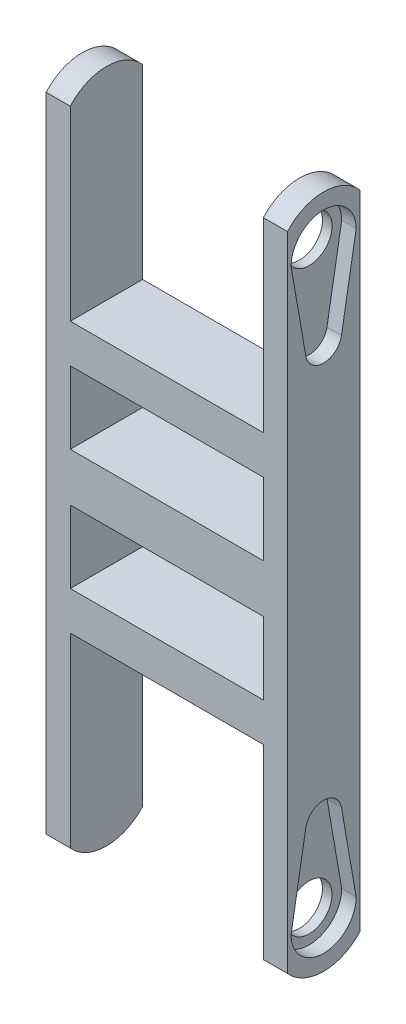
SolidWorks part; units mm, degrees
ref_plane "Front Plane" through (0, 0, 0) normal (0, 0, 1) x (1, 0, 0)
ref_plane "Top Plane" through (0, 0, 0) normal (0, 1, 0) x (1, 0, 0)
ref_plane "Right Plane" through (0, 0, 0) normal (1, 0, 0) x (0, 0, -1)
sketch "Sketch1" plane through (0, 0, 0) normal (0, 0, 1) x (1, 0, 0)
  line L1 (-30, -70) -> (30, -70)
  line L2 (-30, -70) -> (-30, 70)
  line L3 (-30, 70) -> (30, 70)
  line L4 (30, -70) -> (30, 70)
  line L5 (-30, -70) -> (30, 70) construction
  line L6 (-30, 70) -> (30, -70) construction
  point P0 (0, 0)
  dimension "D1" = 140
  dimension "D2" = 60
extrude "Boss-Extrude1" add sketch "Sketch1" along normal blind 15
sketch "Sketch2" plane through (0, 0, 15) normal (0, 0, 1) x (1, 0, 0)
  line L0 (30, 70) -> (-30, 70) construction
  line L1 (-20.025, 70) -> (20.025, 70)
  line L2 (-20.025, 70) -> (-20.025, 28)
  line L3 (-20.025, 28) -> (20.025, 28)
  line L4 (20.025, 70) -> (20.025, 28)
  line L5 (-30, 0) -> (30, 0) construction
  line L6 (-30, 70) -> (-30, -70) construction
  line L7 (30, -70) -> (30, 70) construction
  line L8 (-20.025, -28) -> (20.025, -28)
  line L9 (20.025, -70) -> (20.025, -28)
  line L10 (-20.025, -70) -> (20.025, -70)
  line L11 (-20.025, -70) -> (-20.025, -28)
  point P6 (0, 28)
  dimension "D1" = 40.05
  dimension "D2" = 42
extrude "Cut-Extrude1" cut sketch "Sketch2" against normal through all
sketch "Sketch3" plane through (0, 0, 15) normal (0, 0, 1) x (1, 0, 0)
  line L0 (20.025, -28) -> (-20.025, -28) construction
  line L1 (-20.025, -20) -> (20.025, -20)
  line L2 (-20.025, -20) -> (-20.025, -5)
  line L3 (-20.025, -5) -> (20.025, -5)
  line L4 (20.025, -20) -> (20.025, -5)
  line L5 (-20.025, -28) -> (-20.025, -70) construction
  line L6 (20.025, -70) -> (20.025, -28) construction
  line L7 (-30, 0) -> (30, 0) construction
  line L8 (-30, 70) -> (-30, -70) construction
  line L9 (30, -70) -> (30, 70) construction
  line L10 (-20.025, 5) -> (20.025, 5)
  line L11 (20.025, 20) -> (20.025, 5)
  line L12 (-20.025, 20) -> (20.025, 20)
  line L13 (-20.025, 20) -> (-20.025, 5)
  dimension "D1" = 8
  dimension "D2" = 15
extrude "Cut-Extrude2" cut sketch "Sketch3" against normal through all
sketch "Sketch4" plane through (-30, 0, 0) normal (-1, 0, 0) x (0, 0, 1)
  line L0 (0, 0) -> (15, 0) construction
  line L1 (15, 70) -> (15, -70) construction
  line L2 (15, 70) -> (0, 70) construction
  line L3 (17.5, 60) -> (21.5, 60)
  line L4 (-6.5, 60) -> (-2.5, 60)
  line L5 (-6.5, 60) -> (-6.5, 90)
  line L6 (-6.5, 90) -> (21.5, 90)
  line L7 (21.5, 60) -> (21.5, 90)
  line L8 (-6.5, -60) -> (-6.5, -90)
  line L9 (-6.5, -90) -> (21.5, -90)
  line L10 (21.5, -60) -> (21.5, -90)
  line L11 (17.5, -60) -> (21.5, -60)
  line L12 (-6.5, -60) -> (-2.5, -60)
  arc A0 (17.5, 60) -> (-2.5, 60) centre (7.5, 60) ccw
  arc A1 (17.5, -60) -> (-2.5, -60) centre (7.5, -60) cw
  dimension "D1" = 20
  dimension "D2" = 7.5
  dimension "D3" = 30
  dimension "D4" = 28
  dimension "D5" = 4
extrude "Cut-Extrude3" cut sketch "Sketch4" against normal through all
sketch "Sketch5" plane through (30, 0, 0) normal (1, 0, 0) x (0, 0, -1)
  line L0 (0, 0) -> (-15, 0) construction
  line L1 (-15, -66.6144) -> (-15, 66.6144) construction
  circle A0 centre (-7.5, 60) radius 4.75
  circle A1 centre (-7.5, -60) radius 4.75
  dimension "D1" = 9.5
extrude "Cut-Extrude4" cut sketch "Sketch5" against normal up to next
sketch "Sketch6" plane through (0, 0, 0) normal (0, 0, -1) x (-1, 0, 0)
  line L0 (25.0125, 70) -> (25.0125, -70)
  line L1 (30, 70) -> (20.025, 70) construction
  line L2 (20.025, -70) -> (30, -70) construction
  line L3 (25.0125, -70) -> (30, -70)
  line L4 (30, -70) -> (30, 70)
  line L5 (30, 70) -> (25.0125, 70)
  line L6 (0, 70) -> (0, -70) construction
  line L7 (-25.0125, -70) -> (-30, -70)
  line L8 (-30, 70) -> (-25.0125, 70)
  line L9 (-30, -70) -> (-30, 70)
  line L10 (-25.0125, 70) -> (-25.0125, -70)
extrude "Cut-Extrude5" cut sketch "Sketch6" against normal through all
sketch "Sketch7" plane through (25.0125, 0, 0) normal (1, 0, 0) x (0, 0, -1)
  line L0 (-7.5, 60) -> (-7.5, 43) construction
  line L1 (-14.25, 60) -> (-11.195, 42.3601)
  line L2 (-0.75, 60) -> (-3.805, 42.3601)
  line L3 (0, 0) -> (-15, 0) construction
  line L4 (-15, -66.6144) -> (-15, 66.6144) construction
  line L5 (-0.75, -60) -> (-3.805, -42.3601)
  line L6 (-14.25, -60) -> (-11.195, -42.3601)
  arc A0 (-0.75, 60) -> (-14.25, 60) centre (-7.5, 60) ccw
  arc A1 (-11.195, 42.3601) -> (-3.805, 42.3601) centre (-7.5, 43) ccw
  arc A2 (-11.195, -42.3601) -> (-3.805, -42.3601) centre (-7.5, -43) cw
  arc A3 (-0.75, -60) -> (-14.25, -60) centre (-7.5, -60) cw
  dimension "D1" = 13.5
  dimension "D2" = 7.5
  dimension "D3" = 17
extrude "Cut-Extrude6" cut sketch "Sketch7" against normal blind 3
